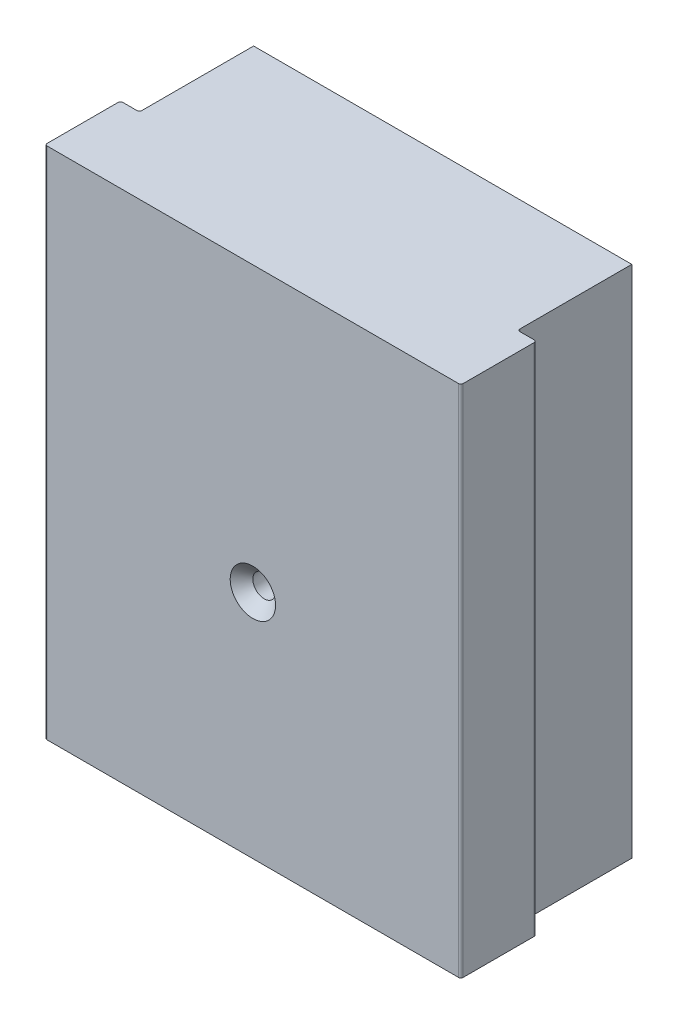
SolidWorks part; units mm, degrees
ref_plane "Plan de face" through (0, 0, 0) normal (0, 0, 1) x (1, 0, 0)
ref_plane "Plan de dessus" through (0, 0, 0) normal (0, 1, 0) x (1, 0, 0)
ref_plane "Plan de droite" through (0, 0, 0) normal (1, 0, 0) x (0, 0, -1)
sketch "Esquisse1" plane through (0, 0, 0) normal (0, 1, 0) x (1, 0, 0)
  line L0 (0, 0) -> (0, 25.1) construction
  line L1 (-25, 25.1) -> (25, 25.1)
  line L2 (-27.5, 10) -> (-27.5, 0)
  line L3 (-27.5, 0) -> (27.5, 0)
  line L4 (27.5, 10) -> (27.5, 0)
  line L8 (-27.5, 10) -> (-25, 10)
  line L9 (-25, 25.1) -> (-25, 10)
  line L12 (27.5, 10) -> (25, 10)
  line L13 (25, 25.1) -> (25, 10)
  dimension "D1" = 25.1
  dimension "D2" = 55
  dimension "D3" = 10
  dimension "D4" = 50
extrude "section profilé" add sketch "Esquisse1" along normal blind 68
fillet "Congé2" radius 0.3 6 edges at (-27.5, 34, 0) (-27.5, 34, -10) (-25, 34, -10) (27.5, 34, 0) (27.5, 34, -10) (25, 34, -10)
ref_plane "Plan pour buse" through (0, 0, -1.5) normal (0, 0, 1) x (1, 0, 0)
sketch "Esquisse2" plane through (0, 0, -1.5) normal (0, 0, 1) x (1, 0, 0)
  line L0 (0, 0) -> (0, 68) construction
  line L1 (25, 68) -> (-25, 68) construction
  circle A0 centre (0, 30.5) radius 1.5
  dimension "D1" = 30.5
  dimension "D2" = 3
extrude "carotte centrale" cut sketch "Esquisse2" against normal through all draft 2
sketch "Esquisse3" plane through (0, 0, -1.5) normal (0, 0, -1) x (-1, 0, 0)
  circle A1 centre (0, 30.5) radius 1.5
  circle A2 centre (0, 30.5) radius 1.5
  dimension "D1" = 0
extrude "cône d'appui buse centrale" cut sketch "Esquisse3" against normal blind 68 draft 45
